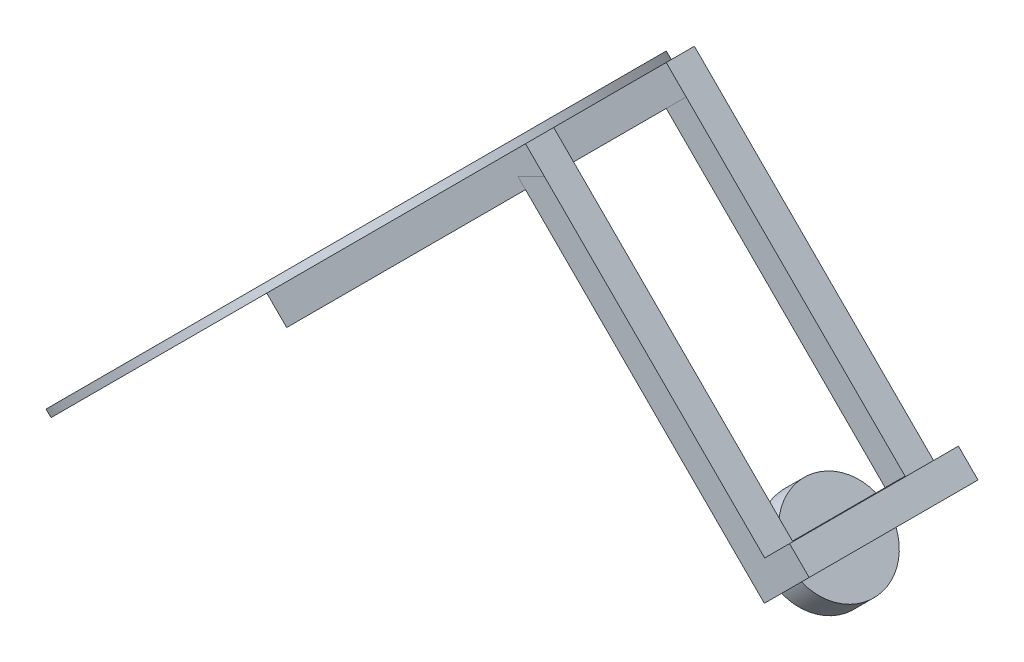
SolidWorks part; units mm, degrees
ref_plane "Plan de face" through (0, 0, 0) normal (0, 0, 1) x (1, 0, 0)
ref_plane "Plan de dessus" through (0, 0, 0) normal (0, 1, 0) x (1, 0, 0)
ref_plane "Plan de droite" through (0, 0, 0) normal (1, 0, 0) x (0, 0, -1)
sketch "Esquisse1" plane through (0, 0, 0) normal (1, 0, 0) x (0, 0, -1)
  line L1 (-12.7, -12.7) -> (12.7, -12.7)
  line L2 (-12.7, -12.7) -> (-12.7, 12.7)
  line L3 (-12.7, 12.7) -> (12.7, 12.7)
  line L4 (12.7, -12.7) -> (12.7, 12.7)
  line L5 (-12.7, -12.7) -> (12.7, 12.7) construction
  line L6 (-12.7, 12.7) -> (12.7, -12.7) construction
  line L7 (114.3, -12.7) -> (139.7, -12.7)
  line L8 (114.3, -12.7) -> (114.3, 12.7)
  line L9 (114.3, 12.7) -> (139.7, 12.7)
  line L10 (139.7, -12.7) -> (139.7, 12.7)
  line L11 (114.3, -12.7) -> (139.7, 12.7) construction
  line L12 (114.3, 12.7) -> (139.7, -12.7) construction
  point P0 (0, 0)
  point P6 (127, 0)
  dimension "D1" = 25.4
  dimension "D2" = 25.4
  dimension "D3" = 25.4
  dimension "D4" = 25.4
  dimension "D5" = 127
extrude "Boss.-Extru.1" add sketch "Esquisse1" along normal blind 330.2
sketch "Esquisse2" plane through (0, 0, -114.3) normal (0, 0, 1) x (1, 0, 0)
  line L0 (330.2, 12.7) -> (330.2, -12.7) construction
  line L1 (304.8, -12.7) -> (330.2, -12.7)
  line L2 (304.8, -12.7) -> (304.8, 12.7)
  line L3 (304.8, 12.7) -> (330.2, 12.7)
  line L4 (330.2, -12.7) -> (330.2, 12.7)
  line L5 (304.8, -12.7) -> (330.2, 12.7) construction
  line L6 (304.8, 12.7) -> (330.2, -12.7) construction
  line L8 (330.2, 12.7) -> (0, 12.7) construction
  point P0 (317.5, 0)
  dimension "D1" = 25.4
  dimension "D2" = 25.4
  dimension "D3" = 12.7
  dimension "D4" = 12.7
extrude "Boss.-Extru.2" add sketch "Esquisse2" along normal up to next
sketch "Esquisse3" plane through (0, 0, 0) normal (0, 1, 0) x (1, 0, 0)
  line L0 (12.7, 114.3) -> (12.7, 12.7) construction
  line L1 (304.8, 114.3) -> (0, 114.3) construction
  line L2 (304.8, 12.7) -> (0, 12.7) construction
  line L3 (0, 139.7) -> (0, 114.3) construction
  dimension "D1" = 12.7
pattern_circular "Répétition circulaire1" count 2 every 90 about axis through (12.7, 0, 0) along (0, 0, 1)
sketch "Esquisse4" plane through (0, 0, 0) normal (-1, 0, 0) x (0, 0, 1)
  line L0 (12.7, -317.5) -> (-139.7, -317.5) construction
  line L1 (-139.7, -317.5) -> (-139.7, 12.7) construction
  circle A0 centre (-63.5, -304.8) radius 228.6
  dimension "D1" = 457.2
  dimension "D2" = 12.7
  dimension "D3" = 76.2
extrude "Boss.-Extru.3" add sketch "Esquisse4" along normal blind 6.35
sketch "Esquisse5" plane through (0, 12.7, 0) normal (0, 1, 0) x (1, 0, 0)
  line L0 (330.2, 139.7) -> (0, 139.7) construction
  line L1 (330.2, -12.7) -> (305.2309, -12.7)
  line L2 (330.2, -12.7) -> (330.2, 139.7)
  line L3 (330.2, 139.7) -> (305.2309, 139.7)
  line L4 (305.2309, -12.7) -> (305.2309, 139.7)
extrude "Boss.-Extru.4" add sketch "Esquisse5" along normal blind 31.75
sketch "Esquisse6" plane through (0, -12.7, 0) normal (0, -1, 0) x (1, 0, 0)
  circle A0 centre (317.6914, -63.5) radius 44.45
  dimension "D1" = 88.9
extrude "Boss.-Extru.5" add sketch "Esquisse6" along normal blind 25.4
move or copy body "Corps-Déplacer/Copier1"
ref_point "Point1"
ref_point "Point2"
